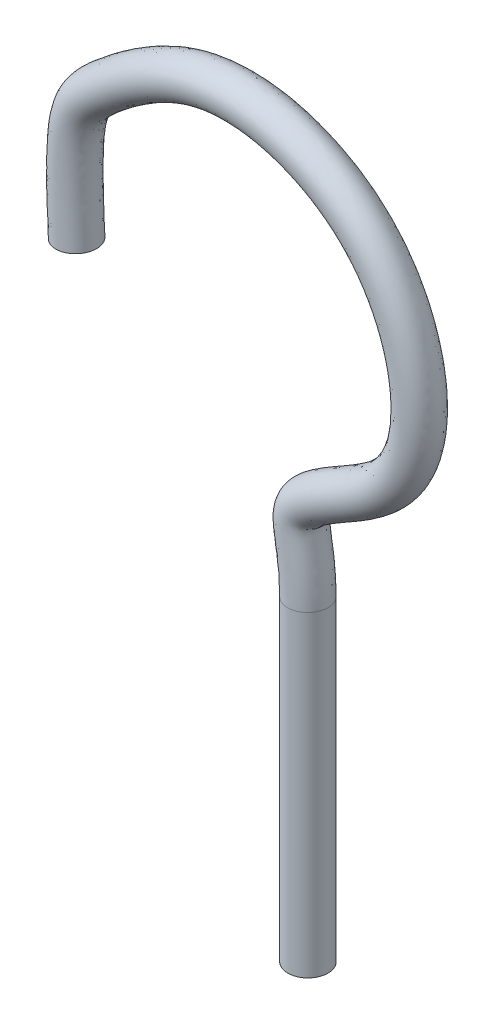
SolidWorks part; units mm, degrees
ref_plane "Front" through (0, 0, 0) normal (0, 0, 1) x (1, 0, 0)
ref_plane "Top" through (0, 0, 0) normal (0, 1, 0) x (1, 0, 0)
ref_plane "Right" through (0, 0, 0) normal (1, 0, 0) x (0, 0, -1)
sketch "Sketch2" plane through (0, 0, 0) normal (0, 0, 1) x (1, 0, 0)
  line L0 (0, 0) -> (0, 50.212)
  spline S0 degree 3 poles (0, 50.212) (-0.1286, 57.8018) (-4.2158, 63.6877) (20.8885, 71.894) (17.591, 98.252) (1.3351, 112.5808) (-17.4037, 115.4791) (-36.5961, 101.2676) (-37.4345, 98.1113) (-36.7053, 81.0969) knots 0 0 0 0 0.093717 0.216816 0.428649 0.543822 0.702872 0.822926 1 1 1 1
sketch "Sketch3" plane through (0, 0, 0) normal (0, 1, 0) x (1, 0, 0)
  circle A0 centre (0, 0) radius 3.175
  dimension "D1" = 6.35
sweep "Sweep1" add profiles "Sketch3" path "Sketch2"
ref_plane "Plane1" through (0, 0, 152.4) normal (0, 0, 1) x (1, 0, 0)
sketch "Sketch5" plane through (0, 0, 152.4) normal (0, 0, 1) x (1, 0, 0)
  point P0 (-17.561, 43.898)
